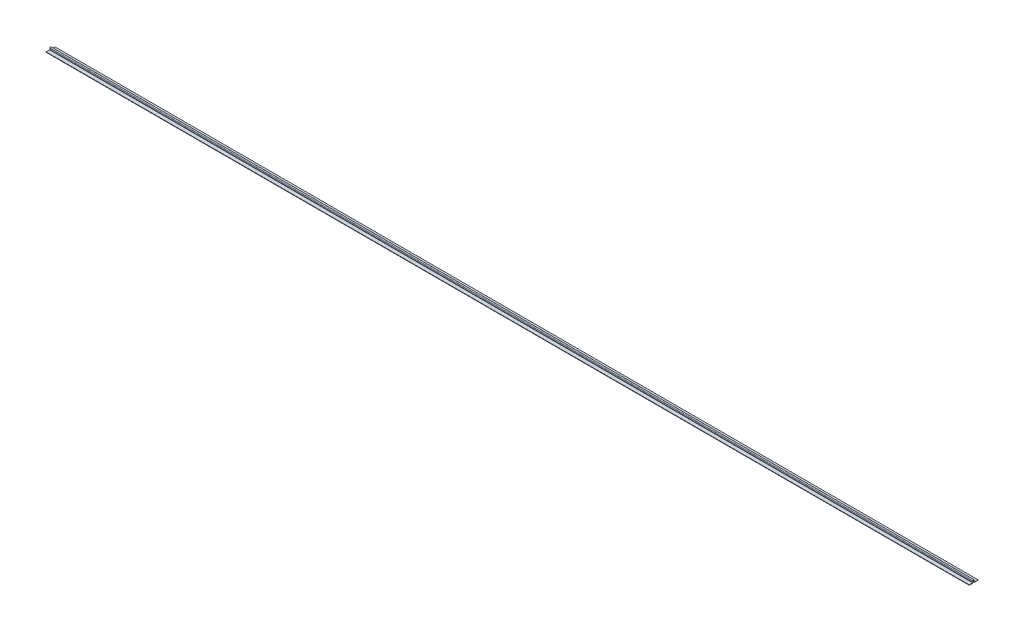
SolidWorks part; units mm, degrees
ref_plane "Front Plane" through (0, 0, 0) normal (0, 0, 1) x (1, 0, 0)
ref_plane "Top Plane" through (0, 0, 0) normal (0, 1, 0) x (1, 0, 0)
ref_plane "Right Plane" through (0, 0, 0) normal (1, 0, 0) x (0, 0, -1)
sketch "Sketch1" plane through (0, 0, 0) normal (1, 0, 0) x (0, 0, -1)
  line L0 (-1.75, 0) -> (1.75, 0) construction
  line L1 (-1.75, 4) -> (-1.75, 0.5)
  line L2 (1.75, 4) -> (1.75, 0.5)
  line L3 (-2.25, 0) -> (-11.75, 0)
  line L4 (2.25, 0) -> (11.75, 0)
  line L5 (-11.75, 0) -> (-11.75, -1)
  line L6 (-11.75, -1) -> (-1.75, -1)
  line L7 (11.75, 0) -> (11.75, -1)
  line L8 (11.75, -1) -> (1.75, -1)
  line L9 (0.9169, -0.1876) -> (0.9169, -0.1876)
  line L10 (0.9169, -0.1876) -> (0.9169, -0.1876)
  line L11 (0.9169, -0.1876) -> (0.9169, -0.1876)
  line L12 (0.75, 4) -> (0.75, 0.5)
  line L13 (-0.75, 4) -> (-0.75, 0.5)
  line L14 (-0.9169, -0.1876) -> (-0.9169, -0.1876)
  line L15 (-0.9169, -0.1876) -> (-0.9169, -0.1876)
  line L16 (-0.9169, -0.1876) -> (-0.9169, -0.1876)
  line L17 (-0.75, 0.5) -> (-0.75, 0)
  line L18 (0.75, 0.5) -> (0.75, 0)
  line L19 (11.75, -1) -> (1.5, -1) construction
  line L20 (-11.75, -1) -> (-1.5, -1) construction
  arc A0 (1.75, 4) -> (-1.75, 4) centre (0, 4) ccw
  arc A1 (-1.75, 0.5) -> (-2.25, 0) centre (-2.25, 0.5) cw
  arc A2 (2.25, 0) -> (1.75, 0.5) centre (2.25, 0.5) cw
  arc A3 (1.75, -1) -> (0.75, 0) centre (1.75, 0) cw
  arc A4 (0.75, 4) -> (-0.75, 4) centre (0, 4) ccw
  arc A5 (-0.75, 0) -> (-1.75, -1) centre (-1.75, 0) cw
  arc A6 (0.9169, -0.1876) -> (0.75, 0.5) centre (2.25, 0.5) cw construction
  arc A7 (-0.75, 0.5) -> (-0.9169, -0.1876) centre (-2.25, 0.5) cw construction
  point P4 (0, 0)
  point P38 (0.75, -1)
  point P42 (-0.75, -1)
  dimension "D2" = 3.5
  dimension "D4" = 0.5
  dimension "D5" = 0.5
  dimension "D10" = 1
  dimension "D1" = 10
  dimension "D3" = 10
  dimension "D6" = 1
  dimension "D7" = 1
  dimension "D8" = 1
  dimension "D11" = 5
  dimension "D9" = 1
extrude "Boss-Extrude1" add sketch "Sketch1" along normal mid plane 2455 contours A0 L1 A1 L3 L5 L6 A5 L17 L13 A4 L12 L18 A3 L8 L7 L4 A2 L2
